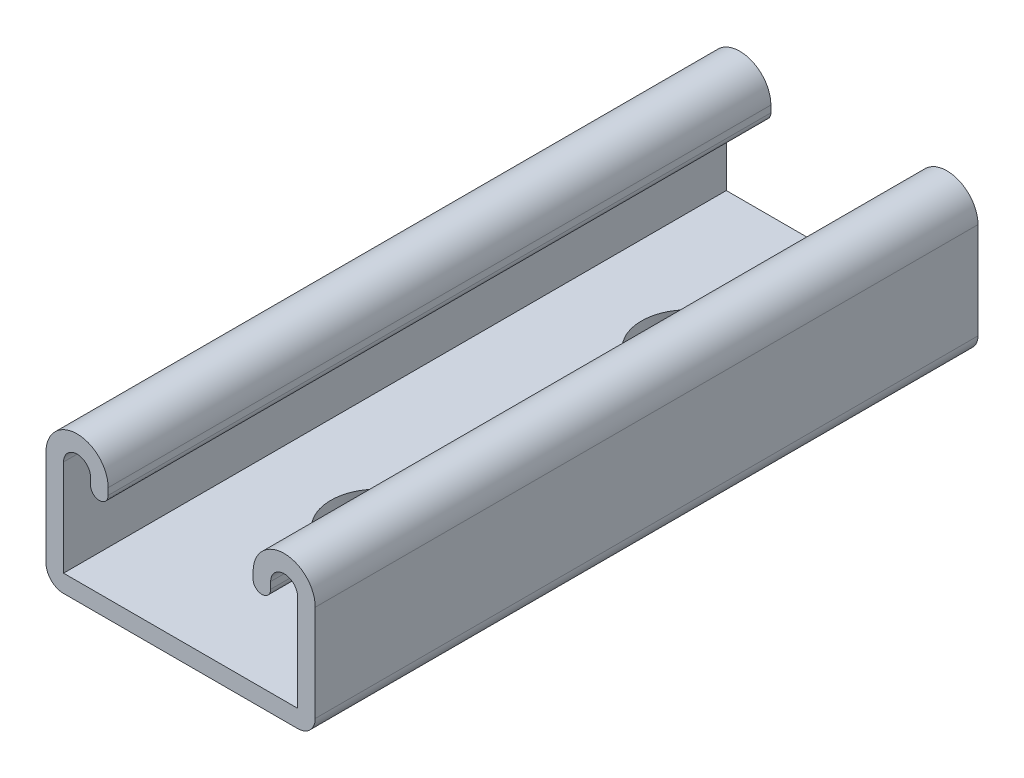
SolidWorks part; units mm, degrees
ref_plane "Plane1" through (0, 0, 0) normal (0, 0, 1) x (1, 0, 0)
ref_plane "Plane2" through (0, 0, 0) normal (0, 1, 0) x (1, 0, 0)
ref_plane "Plane3" through (0, 0, 0) normal (1, 0, 0) x (0, 0, -1)
sketch "Sketch1" plane through (0, 0, 0) normal (0, 0, 1) x (1, 0, 0)
  line L0 (-20.6375, 8.3693) -> (-20.6375, -6.4008)
  line L1 (-17.9451, -9.0932) -> (17.9451, -9.0932)
  line L2 (20.6375, -6.4008) -> (20.6375, 8.3693)
  line L3 (11.1125, 8.3693) -> (11.1125, 7.3343)
  line L4 (-11.1125, 8.3693) -> (-11.1125, 7.3343)
  line L5 (-13.8049, 8.3693) -> (-13.8049, 7.3343)
  line L6 (-17.9451, 8.3693) -> (-17.9451, -6.4008)
  line L7 (-17.9451, -6.4008) -> (17.9451, -6.4008)
  line L8 (17.9451, -6.4008) -> (17.9451, 8.3693)
  line L9 (13.8049, 8.3693) -> (13.8049, 7.3343)
  line L10 (-25.4, 13.1318) -> (25.4, 13.1318) construction
  line L11 (-12.8524, 5.9881) -> (12.8524, 5.9881) construction
  arc A0 (20.6375, 8.3693) -> (11.1125, 8.3693) centre (15.875, 8.3693) ccw
  arc A1 (-20.6375, 8.3693) -> (-11.1125, 8.3693) centre (-15.875, 8.3693) cw
  arc A2 (-17.9451, -9.0932) -> (-20.6375, -6.4008) centre (-17.9451, -6.4008) cw
  arc A3 (17.9451, -9.0932) -> (20.6375, -6.4008) centre (17.9451, -6.4008) ccw
  arc A4 (-17.9451, 8.3693) -> (-13.8049, 8.3693) centre (-15.875, 8.3693) cw
  arc A5 (17.9451, 8.3693) -> (13.8049, 8.3693) centre (15.875, 8.3693) ccw
  arc A6 (11.1125, 7.3343) -> (13.8049, 7.3343) centre (12.4587, 7.3343) ccw
  arc A7 (-11.1125, 7.3343) -> (-13.8049, 7.3343) centre (-12.4587, 7.3343) cw
  dimension "D1" = 2.6924
  dimension "D3" = 20.6375
  dimension "Width" = 41.275
  dimension "D5" = 9.0932
  dimension "D6" = 9.525
  dimension "D7" = 22.225
  dimension "D8" = 13.1318
  dimension "D9" = 7.1437
  dimension "gauge" = 2.6924
extrude "Base-Extrude" add sketch "Sketch1" along normal blind 101.6
other "Hole1"
sketch "Sketch3" plane through (0, -9.0932, 0) normal (0, -1, 0) x (1, 0, 0)
  circle A0 centre (0, 23.8125) radius 7.1438
  dimension "D1" = 14.2875
  dimension "D2" = 23.8125
pattern_linear "LPattern2" count 2 spacing 47.625 along (0, 0, 1) of "Hole1"
equation "\"D3@Sketch1\" = \"Width@Sketch1\" / 2"
equation "\"D7@Sketch1\" = \"Width@Sketch1\" - 2 * \"D6@Sketch1\""
equation "\"D1@Sketch1\" = \"gauge@Sketch1\""
equation "\"D1@LPattern2\" = \"D1@Base-Extrude\" / \"D3@LPattern2\""
